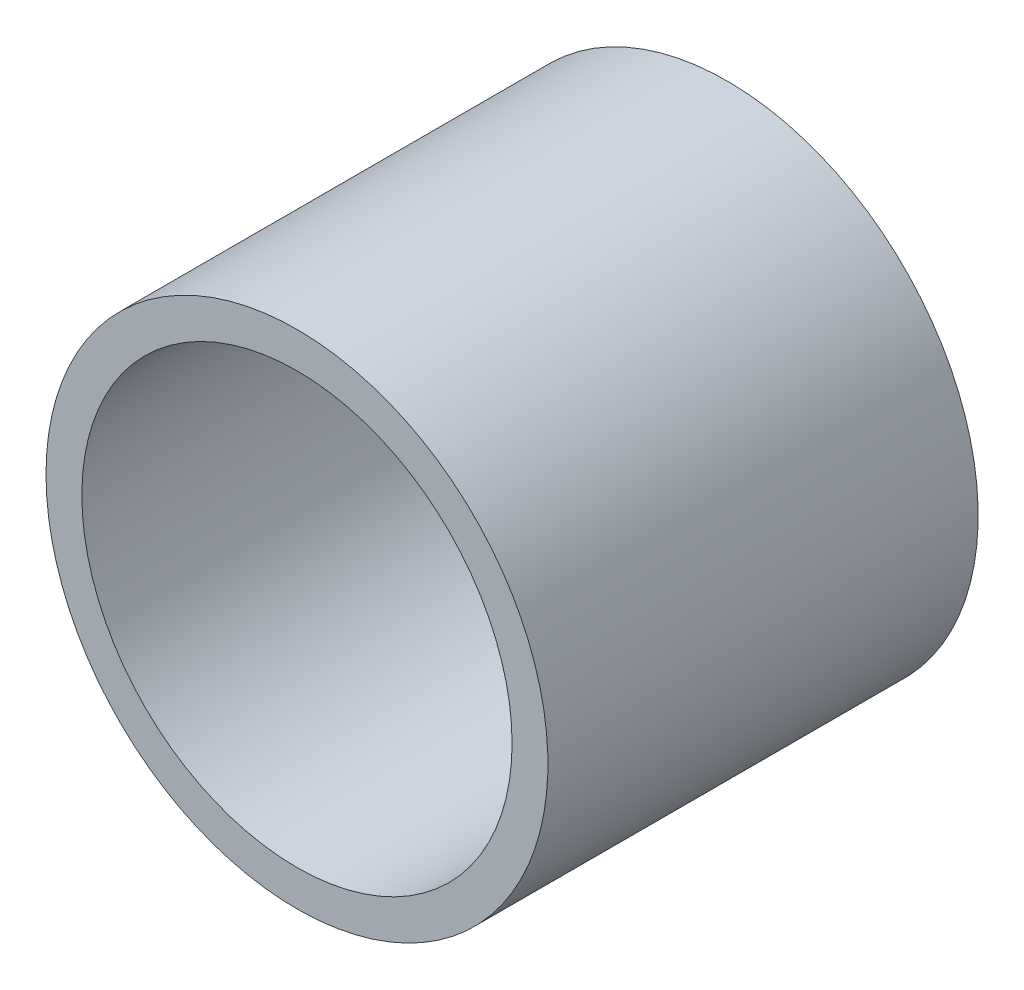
SolidWorks part; units mm, degrees
ref_plane "Plan de face" through (0, 0, 0) normal (0, 0, 1) x (1, 0, 0)
ref_plane "Plan de dessus" through (0, 0, 0) normal (0, 1, 0) x (1, 0, 0)
ref_plane "Plan de droite" through (0, 0, 0) normal (1, 0, 0) x (0, 0, -1)
ref_plane "Plan4" through (0, 0, 0) normal (0, -1, 0) x (1, 0, 0)
sketch "Esquisse1" plane through (0, 0, 0) normal (0, -1, 0) x (1, 0, 0)
  line L0 (7, 12) -> (6, 12)
  line L1 (6, 12) -> (6, 0)
  line L2 (6, 0) -> (7, 0)
  line L3 (7, 0) -> (7, 12)
  line L4 (0, 17) -> (0, 0) construction
  dimension "D1" = 6
  dimension "D2" = 1
  dimension "D3" = 12
revolve "Révolution1" add sketch "Esquisse1" angle 360 about L4
